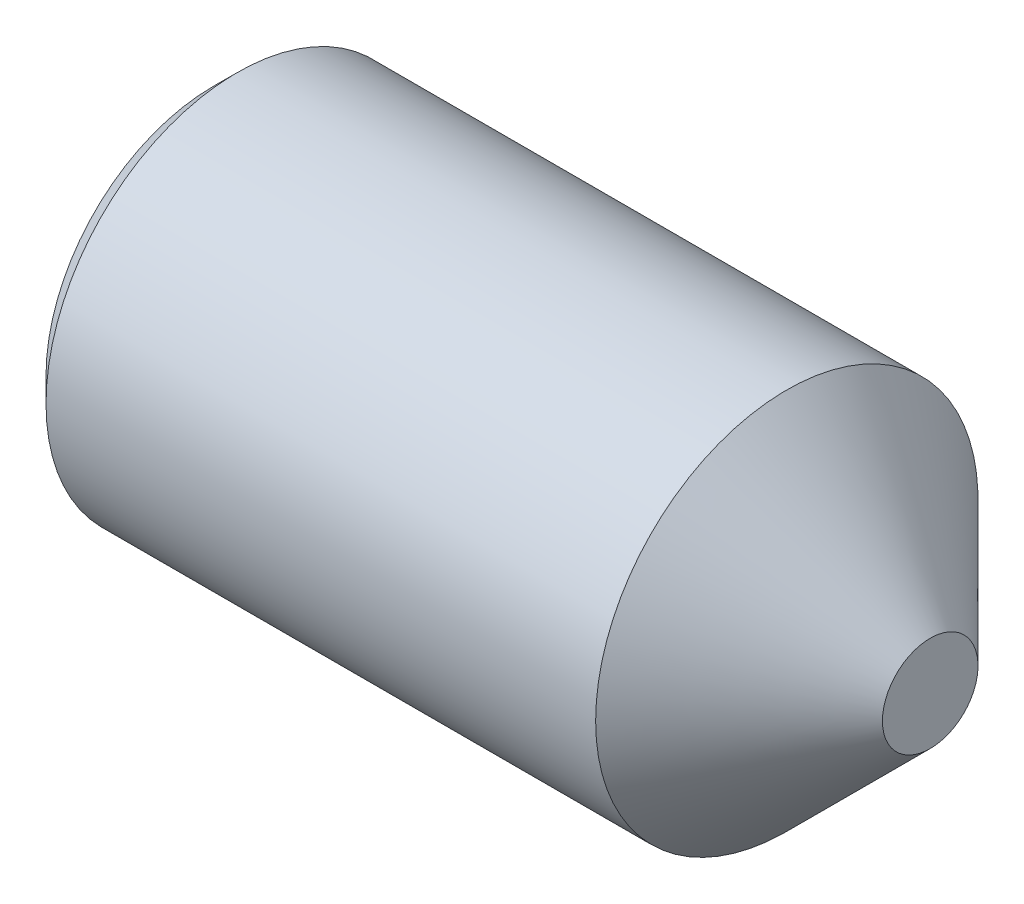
SolidWorks part; units mm, degrees
ref_plane "Front" through (0, 0, 0) normal (0, 0, 1) x (1, 0, 0)
ref_plane "Top" through (0, 0, 0) normal (0, 1, 0) x (1, 0, 0)
ref_plane "Right" through (0, 0, 0) normal (1, 0, 0) x (0, 0, -1)
sketch "Sketch1" plane through (0, 0, 0) normal (0, 0, 1) x (1, 0, 0)
  line L0 (0, 0) -> (3, 0)
  line L1 (3, 0) -> (3, 0.2)
  line L2 (3, 0.2) -> (2.4, 0.8)
  line L3 (2.4, 0.8) -> (0.1, 0.8)
  line L4 (0.1, 0.8) -> (0, 0.7)
  line L5 (0, 0.7) -> (0, 0)
  line L6 (-14.7741, 0) -> (12.5137, 0) construction
  dimension "D1" = 45
  dimension "l" = 3
  dimension "D2" = 45
  dimension "dt" = 0.4
  dimension "d" = 1.6
  dimension "df" = 1.4
revolve "Base" add sketch "Sketch1" angle 360 about L6
sketch "Sketch2" plane through (0, 0.2203, -0.1392) normal (-1, 0, 0) x (0, 0, 1)
  line L1 (0.5433, -0.2203) -> (0.3413, 0.1297)
  line L2 (0.3413, 0.1297) -> (-0.0629, 0.1297)
  line L3 (-0.0629, 0.1297) -> (-0.2649, -0.2203)
  line L4 (-0.2649, -0.2203) -> (-0.0629, -0.5703)
  line L5 (-0.0629, -0.5703) -> (0.3413, -0.5703)
  line L6 (0.3413, -0.5703) -> (0.5433, -0.2203)
  circle A0 centre (0.1392, -0.2203) radius 0.35 construction
  dimension "s" = 0.7
extrude "HexagonSocket" cut sketch "Sketch2" against normal blind 0.7
sketch "Sketch3" plane through (0, 0, 0) normal (0, 0, 1) x (1, 0, 0)
  line L0 (0.7, 0) -> (-2.4777, 0) construction
  line L2 (0.7, 0.35) -> (0.9021, 0)
  line L3 (0.9021, 0) -> (0.7, -0.35) construction
  line L4 (0.7, 0.35) -> (0.7, 0)
  line L5 (0.7, 0) -> (0.9021, 0)
  dimension "D1" = 120
revolve "Cut-Revolve" cut sketch "Sketch3" angle 360 about L0
sketch "Sketch4" plane through (0, 0, 0) normal (0, 0, 1) x (1, 0, 0)
  line L0 (0.1, 0.7134) -> (0.15, 0.8)
  line L1 (0.15, 0.8) -> (0.15, 0.9)
  line L2 (0.15, 0.9) -> (0.05, 0.9)
  line L3 (0.05, 0.9) -> (0.05, 0.8)
  line L4 (0.05, 0.8) -> (0.1, 0.7134)
  line L5 (0, 0) -> (3.2295, 0) construction
  line L6 (0.1, 0.8) -> (0.1, -0.8) construction
  dimension "D1" = 1.6
  dimension "D2" = 0.1
revolve "Cut-Revolve10" [suppressed] cut sketch "Sketch4" angle 360 about L5
pattern_linear "LPattern10" [suppressed] count 25 spacing 0.12 along (1, 0, 0)
equation "\"df@Sketch1\" = \"D2@ThreadCosmetic1\""
equation "\"D1@Sketch4\" = \"d@Sketch1\""
equation "\"D2@Sketch4\" =  ( \"d@Sketch1\" - \"D2@ThreadCosmetic1\" )  / 2"
equation "\"D3@LPattern10\" = \"D2@Sketch4\" * 1.2"
equation "\"D1@LPattern10\" = \"l@Sketch1\" / \"D3@LPattern10\""
